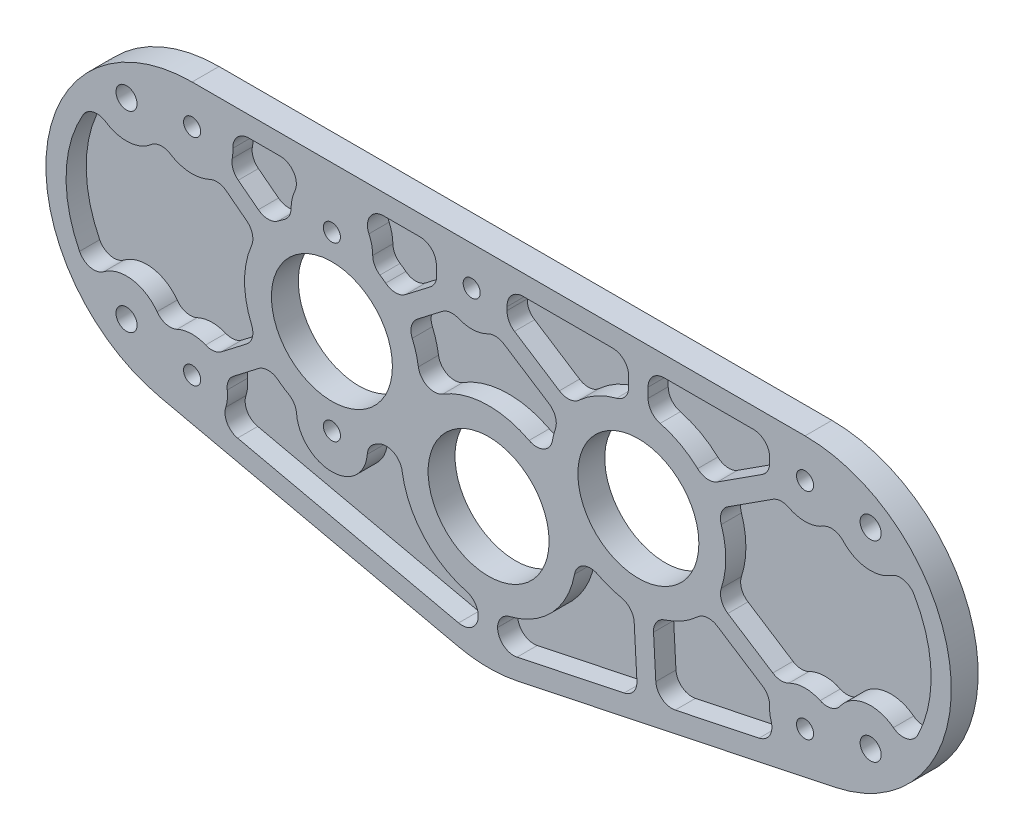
SolidWorks part; units mm, degrees
ref_plane "Front Plane" through (0, 0, 0) normal (0, 0, 1) x (1, 0, 0)
ref_plane "Top Plane" through (0, 0, 0) normal (0, 1, 0) x (1, 0, 0)
ref_plane "Right Plane" through (0, 0, 0) normal (1, 0, 0) x (0, 0, -1)
sketch "Sketch1" plane through (0, 0, 0) normal (0, 0, 1) x (1, 0, 0)
  line L0 (-70.031, 17.272) -> (-3.991, 17.272) construction
  line L1 (-3.991, 17.272) -> (74.749, 17.272) construction
  line L2 (-70.031, 49.276) -> (74.749, 49.276)
  line L3 (-70.031, 42.672) -> (74.749, 42.672) construction
  line L4 (-70.031, 42.672) -> (-70.031, -8.128) construction
  line L5 (-70.031, -8.128) -> (74.749, -8.128) construction
  line L6 (74.749, 42.672) -> (74.749, -8.128) construction
  line L7 (-70.031, -14.732) -> (-29.9849, -14.732) construction
  line L8 (0, -27.94) -> (0, -14.732) construction
  line L9 (-23.7405, -14.732) -> (23.7405, -14.732) construction
  line L10 (29.9849, -14.732) -> (74.749, -14.732) construction
  line L11 (-29.9849, -14.732) -> (-23.7405, -14.732) construction
  line L12 (29.9849, -14.732) -> (23.7405, -14.732) construction
  line L13 (-77.0364, -13.9559) -> (-6.6718, -29.7408)
  line L14 (81.3334, -14.0474) -> (6.2708, -29.828)
  line L15 (-37.011, 17.272) -> (-37.011, 37.592) construction
  line L16 (-37.011, 17.272) -> (-37.011, -3.048) construction
  circle A0 centre (-70.031, 17.272) radius 32.004 construction
  circle A1 centre (-3.991, 17.272) radius 32.004 construction
  circle A2 centre (74.749, 17.272) radius 32.004 construction
  circle A3 centre (-70.031, 17.272) radius 7.62 construction
  circle A4 centre (-3.991, 17.272) radius 7.62 construction
  circle A5 centre (74.749, 17.272) radius 7.62 construction
  circle A6 centre (-37.011, 17.272) radius 25.4 construction
  circle A7 centre (35.379, 17.272) radius 31.75 construction
  circle A8 centre (35.379, 17.272) radius 11.43 construction
  circle A9 centre (0, 0) radius 27.94 construction
  circle A10 centre (-70.031, 17.272) radius 25.4 construction
  circle A11 centre (-3.991, 17.272) radius 25.4 construction
  circle A12 centre (74.749, 17.272) radius 25.4 construction
  circle A13 centre (-70.031, 42.672) radius 2.0193
  circle A14 centre (-3.991, 42.672) radius 2.0193
  circle A15 centre (74.749, 42.672) radius 2.0193
  circle A16 centre (74.749, -8.128) radius 2.0193
  circle A17 centre (-3.9087, -8.1279) radius 2.0193 construction
  circle A18 centre (-70.031, -8.128) radius 2.0193
  arc A19 (-70.031, 49.276) -> (-70.031, -14.732) centre (-70.031, 17.272) ccw construction
  arc A20 (74.749, -14.732) -> (74.749, 49.276) centre (74.749, 17.272) ccw construction
  circle A21 centre (-70.031, 17.272) radius 9.525 construction
  circle A22 centre (-3.991, 17.272) radius 9.525 construction
  circle A23 centre (74.749, 17.272) radius 9.525 construction
  circle A24 centre (-37.011, 17.272) radius 14.2875
  circle A25 centre (35.379, 17.272) radius 14.2875
  arc A26 (-20.6146, -18.8595) -> (20.6146, -18.8595) centre (0, 0) ccw construction
  arc A27 (20.6146, -18.8595) -> (29.9849, -14.732) centre (29.9849, -27.432) cw construction
  arc A28 (-29.9849, -14.732) -> (-20.6146, -18.8595) centre (-29.9849, -27.432) cw construction
  circle A29 centre (0, 0) radius 14.2875
  arc A30 (-20.6146, -18.8595) -> (20.6146, -18.8595) centre (0, 0) ccw construction
  arc A31 (-6.6718, -29.7408) -> (6.2708, -29.828) centre (0, 0) ccw
  arc A32 (-77.0364, -13.9559) -> (-70.031, 49.276) centre (-70.031, 17.272) cw
  arc A33 (81.3334, -14.0474) -> (74.749, 49.276) centre (74.749, 17.272) ccw
  circle A34 centre (0, 0) radius 30.48 construction
  circle A35 centre (-37.011, 37.592) radius 2.0193
  circle A36 centre (-37.011, -3.048) radius 2.0193
  dimension "D1" = 64.008
  dimension "D2" = 15.24
  dimension "D3" = 50.8
  dimension "D4" = 22.86
  dimension "D5" = 55.88
  dimension "D6" = 63.5
  dimension "D7" = 50.8
  dimension "D8" = 4.0386
  dimension "D9" = 19.05
  dimension "D10" = 28.575
  dimension "D12" = 12.7
  dimension "D13" = 28.575
  dimension "D15" = 60.96
  dimension "D18" = 4.0386
  dimension "D11" = 13.208
  dimension "D14" = 39.37
  dimension "D16" = 40.64
  dimension "D19" = 20.32
  dimension "D20" = 20.32
extrude "Boss-Extrude1" add sketch "Sketch1" along normal blind 6.35
sketch "Sketch2" plane through (0, 0, 0) normal (0, 0, -1) x (-1, 0, 0)
  circle A0 centre (85.525, 40.827) radius 2.4892 construction
  circle A1 centre (85.525, -4.449) radius 2.4892 construction
  circle A2 centre (-90.243, -4.449) radius 2.4892 construction
  circle A3 centre (-90.243, 40.827) radius 2.4892 construction
  circle A4 centre (85.525, 40.827) radius 2.4892
  circle A5 centre (85.525, -4.449) radius 2.4892
  circle A6 centre (-90.243, -4.449) radius 2.4892
  circle A7 centre (-90.243, 40.827) radius 2.4892
extrude "Cut-Extrude1" cut sketch "Sketch2" against normal through all
sketch "Sketch5" plane through (0, 0, 6.35) normal (0, 0, 1) x (1, 0, 0)
  line L3 (74.749, 49.276) -> (-70.031, 49.276) construction
  line L4 (6.2708, -29.828) -> (81.3334, -14.0474) construction
  line L5 (-77.0364, -13.9559) -> (-6.6718, -29.7408) construction
  line L6 (-77.5923, -16.4343) -> (-7.2278, -32.2192)
  line L7 (6.7934, -32.3136) -> (81.8559, -16.533)
  line L8 (74.749, 51.816) -> (-70.031, 51.816)
  line L9 (-77.5923, -16.4343) -> (-7.2278, -32.2192)
  line L10 (6.7934, -32.3136) -> (81.8559, -16.533)
  line L11 (74.749, 51.816) -> (-70.031, 51.816)
  line L12 (74.749, 49.276) -> (-70.031, 49.276)
  line L13 (6.2708, -29.828) -> (81.3334, -14.0474)
  line L14 (-77.0364, -13.9559) -> (-6.6718, -29.7408)
  arc A3 (-70.031, 49.276) -> (-77.0364, -13.9559) centre (-70.031, 17.272) ccw construction
  arc A4 (81.3334, -14.0474) -> (74.749, 49.276) centre (74.749, 17.272) ccw construction
  arc A5 (-6.6718, -29.7408) -> (6.2708, -29.828) centre (0, 0) ccw construction
  arc A6 (-70.031, 51.816) -> (-77.5923, -16.4343) centre (-70.031, 17.272) ccw
  arc A7 (-7.2278, -32.2192) -> (6.7934, -32.3136) centre (0, 0) ccw
  arc A8 (81.8559, -16.533) -> (74.749, 51.816) centre (74.749, 17.272) ccw
  arc A9 (-70.031, 51.816) -> (-77.5923, -16.4343) centre (-70.031, 17.272) ccw
  arc A10 (-7.2278, -32.2192) -> (6.7934, -32.3136) centre (0, 0) ccw
  arc A11 (81.8559, -16.533) -> (74.749, 51.816) centre (74.749, 17.272) ccw
  arc A12 (-70.031, 49.276) -> (-77.0364, -13.9559) centre (-70.031, 17.272) ccw
  arc A13 (81.3334, -14.0474) -> (74.749, 49.276) centre (74.749, 17.272) ccw
  arc A14 (-6.6718, -29.7408) -> (6.2708, -29.828) centre (0, 0) ccw
  dimension "D1" = 2.54
extrude "Boss-Extrude2" add sketch "Sketch5" against normal up to surface (6.35 mm away)
sketch "Sketch6" plane through (0, 0, 6.35) normal (0, 0, 1) x (1, 0, 0)
  line L0 (-70.031, 42.672) -> (-85.525, 40.827) construction
  line L1 (0, 0) -> (-0.1902, -28.2569) construction
  line L2 (2.2859, -0.0154) -> (2.0957, -28.2722)
  line L3 (-38.8538, 47.0535) -> (-61.445, 47.0535)
  line L4 (-11.1217, 47.0535) -> (-35.1681, 47.0535)
  line L5 (-37.011, 17.272) -> (-70.031, 42.672) construction
  line L6 (-76.5499, -11.7873) -> (-6.1853, -27.5722)
  line L7 (5.8136, -27.653) -> (80.8761, -11.8724)
  line L8 (74.749, 47.0535) -> (-70.031, 47.0535)
  line L9 (-64.5742, -14.4738) -> (-6.1853, -27.5722)
  line L10 (5.8136, -27.653) -> (69.1401, -14.3397)
  line L11 (67.6183, 47.0535) -> (3.1398, 47.0535)
  line L12 (-38.4048, 15.4601) -> (-71.4248, 40.8601)
  line L13 (-35.6172, 19.0839) -> (-68.6372, 44.4839)
  line L14 (-69.7607, 40.402) -> (-85.2547, 38.557)
  line L15 (-70.3013, 44.942) -> (-85.7953, 43.097)
  line L16 (-70.031, -8.128) -> (-85.525, -4.449) construction
  line L17 (-70.031, -8.128) -> (-37.011, 17.272) construction
  line L18 (-71.4248, -6.3161) -> (-38.4048, 19.0839)
  line L19 (-68.6372, -9.9399) -> (-35.6172, 15.4601)
  line L23 (35.379, 17.272) -> (74.749, -8.128) construction
  line L24 (36.6183, 19.1929) -> (75.9883, -6.2071)
  line L25 (34.1397, 15.3511) -> (73.5097, -10.0489)
  line L26 (-70.5591, -10.3522) -> (-86.0531, -6.6732)
  line L27 (-69.5029, -5.9038) -> (-84.9969, -2.2249)
  line L28 (74.749, -8.128) -> (90.243, -4.449) construction
  line L29 (74.749, 42.672) -> (35.379, 17.272) construction
  line L30 (75.9883, 40.7511) -> (36.6183, 15.3511)
  line L31 (73.5097, 44.5929) -> (34.1397, 19.1929)
  line L32 (-37.011, 17.272) -> (-3.991, 42.672) construction
  line L33 (-38.4048, 19.0839) -> (-5.3848, 44.4839)
  line L34 (-35.6172, 15.4601) -> (-2.5972, 40.8601)
  line L35 (35.379, 17.272) -> (-3.991, 42.672) construction
  line L36 (34.1397, 15.3511) -> (-5.2303, 40.7511)
  line L37 (36.6183, 19.1929) -> (-2.7517, 44.5929)
  line L38 (-2.2859, 0.0154) -> (-2.4762, -28.2415)
  line L39 (74.2209, -5.9038) -> (89.7149, -2.2249)
  line L40 (75.2771, -10.3522) -> (90.7711, -6.6732)
  line L41 (90.243, 40.827) -> (74.749, 42.672) construction
  line L42 (89.9727, 38.557) -> (74.4787, 40.402)
  line L43 (90.5133, 43.097) -> (75.0193, 44.942)
  line L44 (35.379, 17.272) -> (35.379, 47.0535) construction
  line L45 (33.093, 17.272) -> (33.093, 47.0535)
  line L46 (37.665, 17.272) -> (37.665, 47.0535)
  line L47 (35.379, 17.272) -> (37.4768, -20.9964) construction
  line L48 (37.6616, 17.3971) -> (39.7594, -20.8712)
  line L49 (33.0964, 17.1469) -> (35.1943, -21.1215)
  line L50 (-37.011, -3.048) -> (-37.011, -20.6571) construction
  line L51 (-34.725, -3.048) -> (-34.725, -20.6571)
  line L52 (-39.297, -3.048) -> (-39.297, -20.6571)
  arc A0 (2.2859, -0.0154) -> (-2.2859, 0.0154) centre (0, 0) ccw
  arc A1 (-2.4762, -28.2415) -> (2.0957, -28.2722) centre (-0.1902, -28.2569) ccw
  arc A2 (-69.7607, 40.402) -> (-70.3013, 44.942) centre (-70.031, 42.672) ccw
  arc A3 (-85.7953, 43.097) -> (-85.2547, 38.557) centre (-85.525, 40.827) ccw
  arc A4 (-70.5591, -10.3522) -> (-69.5029, -5.9038) centre (-70.031, -8.128) ccw
  arc A5 (-84.9969, -2.2249) -> (-86.0531, -6.6732) centre (-85.525, -4.449) ccw
  arc A6 (-70.031, 47.0535) -> (-76.5499, -11.7873) centre (-70.031, 17.272) ccw
  arc A7 (-6.1853, -27.5722) -> (5.8136, -27.653) centre (0, 0) ccw
  arc A8 (80.8761, -11.8724) -> (74.749, 47.0535) centre (74.749, 17.272) ccw
  arc A9 (-93.0424, 36.1773) -> (-93.6224, -0.9045) centre (-70.031, 17.272) ccw
  arc A10 (-6.1853, -27.5722) -> (5.8136, -27.653) centre (0, 0) ccw
  arc A11 (98.3404, -0.9045) -> (97.7605, 36.1773) centre (74.749, 17.272) ccw
  arc A12 (74.2209, -5.9038) -> (75.2771, -10.3522) centre (74.749, -8.128) ccw
  arc A13 (90.7711, -6.6732) -> (89.7149, -2.2249) centre (90.243, -4.449) ccw
  arc A14 (89.9727, 38.557) -> (90.5133, 43.097) centre (90.243, 40.827) ccw
  arc A15 (75.0193, 44.942) -> (74.4787, 40.402) centre (74.749, 42.672) ccw
  arc A16 (33.093, 17.272) -> (37.665, 17.272) centre (35.379, 17.272) ccw
  arc A17 (37.665, 47.0535) -> (33.093, 47.0535) centre (35.379, 47.0535) ccw
  arc A18 (37.6616, 17.3971) -> (33.0964, 17.1469) centre (35.379, 17.272) ccw
  arc A19 (35.1943, -21.1215) -> (39.7594, -20.8712) centre (37.4768, -20.9964) ccw
  arc A20 (-34.725, -3.048) -> (-39.297, -3.048) centre (-37.011, -3.048) ccw
  arc A21 (-39.297, -20.6571) -> (-34.725, -20.6571) centre (-37.011, -20.6571) ccw
  circle A265 centre (-85.525, 40.827) radius 8.8392
  arc A266 (-93.0424, 36.1773) -> (-77.664, 36.7852) centre (-85.525, 40.827) ccw
  circle A271 centre (-70.031, 42.672) radius 9.6393
  arc A272 (-77.664, 36.7852) -> (-61.445, 47.0535) centre (-70.031, 42.672) ccw
  circle A274 centre (-37.011, 17.272) radius 20.6375
  arc A275 (-17.2458, 11.3353) -> (-27.5744, 35.6257) centre (-37.011, 17.272) ccw
  circle A277 centre (-37.011, 37.592) radius 9.6393
  arc A278 (-38.8538, 47.0535) -> (-46.4476, 35.6257) centre (-37.011, 37.592) ccw
  circle A280 centre (-3.991, 42.672) radius 8.3693
  arc A281 (-11.1217, 47.0535) -> (3.1398, 47.0535) centre (-3.991, 42.672) ccw
  circle A283 centre (35.379, 17.272) radius 20.6375
  arc A284 (20.4083, 3.0669) -> (14.9707, 14.2051) centre (35.379, 17.272) ccw
  circle A286 centre (0, 0) radius 20.6375
  arc A287 (-19.7652, 5.9367) -> (20.4083, 3.0669) centre (0, 0) ccw
  circle A289 centre (-70.031, -8.128) radius 8.3693
  arc A290 (-64.5742, -14.4738) -> (-76.778, -3.1759) centre (-70.031, -8.128) ccw
  circle A292 centre (-85.525, -4.449) radius 8.8392
  arc A293 (-76.778, -3.1759) -> (-93.6224, -0.9045) centre (-85.525, -4.449) ccw
  circle A295 centre (74.749, -8.128) radius 8.3693
  arc A296 (81.496, -3.1759) -> (69.1401, -14.3397) centre (74.749, -8.128) ccw
  circle A298 centre (90.243, -4.449) radius 8.8392
  arc A299 (98.3404, -0.9045) -> (81.496, -3.1759) centre (90.243, -4.449) ccw
  circle A301 centre (90.243, 40.827) radius 8.8392
  arc A302 (81.8099, 38.1787) -> (97.7605, 36.1773) centre (90.243, 40.827) ccw
  arc A303 (14.9707, 14.2051) -> (-17.2458, 11.3353) centre (0, 0) ccw
  circle A304 centre (74.749, 42.672) radius 8.3693
  arc A305 (67.6183, 47.0535) -> (81.8099, 38.1787) centre (74.749, 42.672) ccw
  arc A307 (-27.5744, 35.6257) -> (-35.1681, 47.0535) centre (-37.011, 37.592) ccw
  circle A308 centre (-37.011, -3.048) radius 8.3693
  arc A309 (-45.2617, -1.6444) -> (-28.7602, -1.6444) centre (-37.011, -3.048) ccw
  arc A310 (-28.7602, -1.6444) -> (-19.7652, 5.9367) centre (-37.011, 17.272) ccw
  arc A311 (-46.4476, 35.6257) -> (-45.2617, -1.6444) centre (-37.011, 17.272) ccw
  arc A312 (-38.4048, 15.4601) -> (-35.6172, 19.0839) centre (-37.011, 17.272) ccw
  arc A313 (-68.6372, 44.4839) -> (-71.4248, 40.8601) centre (-70.031, 42.672) ccw
  arc A316 (-71.4248, -6.3161) -> (-68.6372, -9.9399) centre (-70.031, -8.128) ccw
  arc A317 (-35.6172, 15.4601) -> (-38.4048, 19.0839) centre (-37.011, 17.272) ccw
  arc A320 (36.6183, 19.1929) -> (34.1397, 15.3511) centre (35.379, 17.272) ccw
  arc A321 (73.5097, -10.0489) -> (75.9883, -6.2071) centre (74.749, -8.128) ccw
  arc A324 (75.9883, 40.7511) -> (73.5097, 44.5929) centre (74.749, 42.672) ccw
  arc A325 (34.1397, 19.1929) -> (36.6183, 15.3511) centre (35.379, 17.272) ccw
  arc A326 (-38.4048, 19.0839) -> (-35.6172, 15.4601) centre (-37.011, 17.272) ccw
  arc A327 (-2.5972, 40.8601) -> (-5.3848, 44.4839) centre (-3.991, 42.672) ccw
  arc A328 (34.1397, 15.3511) -> (36.6183, 19.1929) centre (35.379, 17.272) ccw
  arc A329 (-2.7517, 44.5929) -> (-5.2303, 40.7511) centre (-3.991, 42.672) ccw
  point P35 (-53.521, 29.972)
  point P65 (-77.778, 41.7495)
  point P69 (-53.521, 4.572)
  point P81 (55.064, 4.572)
  point P88 (-77.778, -6.2885)
  point P91 (55.064, 29.972)
  point P97 (-20.501, 29.972)
  point P103 (15.694, 29.972)
  point P112 (-0.0951, -14.1284)
  point P118 (82.496, -6.2885)
  point P124 (82.496, 41.7495)
  point P133 (35.379, 32.1627)
  point P140 (36.4279, -1.8622)
  point P147 (-37.011, -11.8525)
  dimension "D15" = 2.286
  dimension "D1" = 4.7625
  dimension "D2" = 6.35
  dimension "D3" = 7.62
  dimension "D4" = 6.35
  dimension "D5" = 7.62
  dimension "D6" = 6.35
  dimension "D7" = 6.35
  dimension "D8" = 6.35
  dimension "D9" = 6.35
  dimension "D10" = 6.35
  dimension "D11" = 6.35
  dimension "D12" = 6.35
  dimension "D13" = 6.35
  dimension "D14" = 6.35
  dimension "D16" = 6.35
extrude "Cut-Extrude3" cut sketch "Sketch6" against normal blind 4.7625
fillet "Fillet3" radius 3.81 60 edges at (67.6183, 47.0535, 3.9688) (37.665, 47.0535, 3.9688) (37.665, 37.7825, 3.9688) (51.3746, 30.3122, 3.9688) (66.7444, 40.2282, 3.9688) (-27.5744, 35.6257, 3.9688) (-22.1477, 31.5894, 3.9688) (-11.7662, 39.5751, 3.9688) (-11.1217, 47.0535, 3.9688) (-35.1681, 47.0535, 3.9688) (-62.2557, -5.0311, 3.9688) (-64.5742, -14.4738, 3.9688) (-2.4755, -28.1489, 3.9688) (-2.424, -20.4946, 3.9688) (-19.7652, 5.9367, 3.9688) (-28.7602, -1.6444, 3.9688) (-45.2617, -1.6444, 3.9688) (69.2231, 36.3864, 3.9688) (53.8532, 26.4704, 3.9688) (53.8532, 8.0736, 3.9688) (69.2231, -1.8424, 3.9688) (81.496, -3.1759, 3.9688) (98.3404, -0.9045, 3.9688) (97.7605, 36.1773, 3.9688) (81.8099, 38.1787, 3.9688) (2.1479, -20.5254, 3.9688) (2.0964, -28.1796, 3.9688) (35.2397, -21.4667, 3.9688) (34.2191, -3.3329, 3.9688) (20.4083, 3.0669, 3.9688) (-54.6619, 27.9655, 3.9688) (-64.0024, 35.1505, 3.9688) (-77.664, 36.7852, 3.9688) (-93.0424, 36.1773, 3.9688) (-93.6224, -0.9045, 3.9688) (-76.778, -3.1759, 3.9688) (-65.0433, -1.4073, 3.9688) (-54.6619, 6.5785, 3.9688) (66.7444, -5.6842, 3.9688) (51.3746, 4.2318, 3.9688) (38.7843, -3.0826, 3.9688) (39.7402, -20.5205, 3.9688) (69.1401, -14.3397, 3.9688) (14.9707, 14.2051, 3.9688) (16.9048, 26.4704, 3.9688) (1.535, 36.3864, 3.9688) (-8.9786, 35.9513, 3.9688) (-19.3601, 27.9655, 3.9688) (-17.2458, 11.3353, 3.9688) (-46.4476, 35.6257, 3.9688) (-38.8538, 47.0535, 3.9688) (-61.445, 47.0535, 3.9688) (-61.2148, 38.7744, 3.9688) (-51.8743, 31.5894, 3.9688) (33.093, 37.7825, 3.9688) (33.093, 47.0535, 3.9688) (3.1398, 47.0535, 3.9688) (4.0136, 40.2282, 3.9688) (19.3834, 30.3122, 3.9688) (-51.8743, 2.9546, 3.9688)
